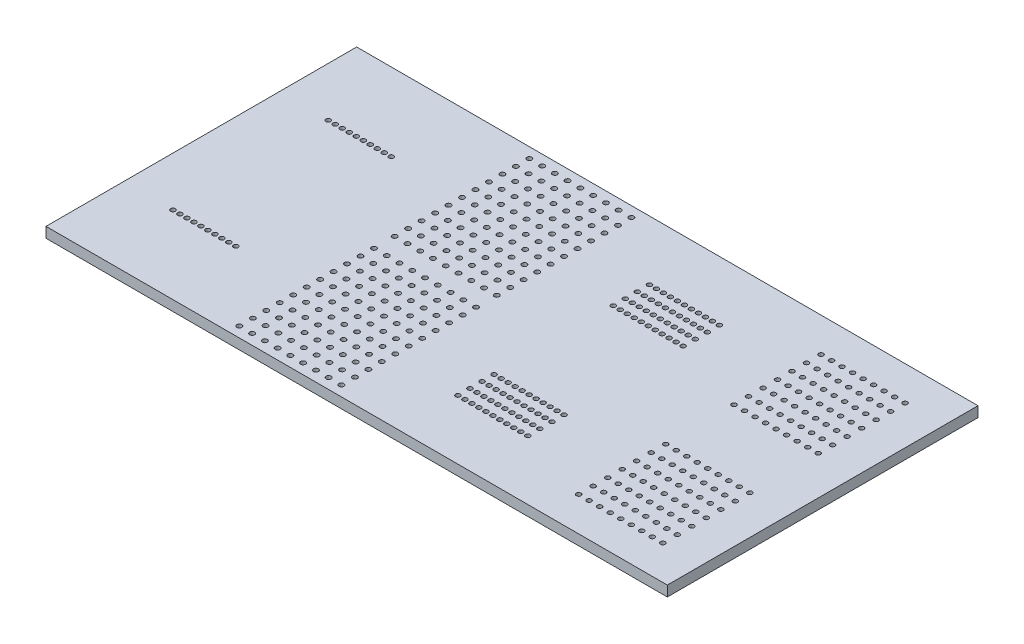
SolidWorks part; units mm, degrees
ref_plane "Plan de face" through (0, 0, 0) normal (0, 0, 1) x (1, 0, 0)
ref_plane "Plan de dessus" through (0, 0, 0) normal (0, 1, 0) x (1, 0, 0)
ref_plane "Plan de droite" through (0, 0, 0) normal (1, 0, 0) x (0, 0, -1)
sketch "Esquisse2" plane through (0, 0, 0) normal (0, 1, 0) x (1, 0, 0)
  line L1 (-60, -15) -> (60, -15)
  line L2 (-60, -15) -> (-60, 15)
  line L3 (-60, 15) -> (60, 15)
  line L4 (60, -15) -> (60, 15)
  line L5 (-60, -15) -> (60, 15) construction
  line L6 (-60, 15) -> (60, -15) construction
  point P0 (0, 0)
  dimension "D1" = 30
  dimension "D2" = 120
extrude "Boss.-Extru.1" add sketch "Esquisse2" along normal blind 2 contours L3 L4 L1 L2
sketch "Cavités" plane through (0, 0, 0) normal (0, 1, 0) x (1, 0, 0)
  line L0 (-60, -15) -> (60, -15) construction
  line L1 (-58.4, 15) -> (-30.4, 15) construction
  line L2 (-58.4, 15) -> (-58.4, -15) construction
  line L3 (-58.4, -15) -> (-30.4, -15) construction
  line L4 (-30.4, 15) -> (-30.4, -15) construction
  line L5 (-60, 15) -> (60, 15) construction
  line L6 (-28.8, 15) -> (-0.8, 15) construction
  line L7 (-28.8, 15) -> (-28.8, -15) construction
  line L8 (-28.8, -15) -> (-0.8, -15) construction
  line L9 (-0.8, 15) -> (-0.8, -15) construction
  line L10 (-30.4, 15) -> (-28.8, 15) construction
  line L11 (0.8, 15) -> (28.8, 15) construction
  line L12 (0.8, 15) -> (0.8, -15) construction
  line L13 (0.8, -15) -> (28.8, -15) construction
  line L14 (28.8, 15) -> (28.8, -15) construction
  line L15 (30.4, 15) -> (58.4, 15) construction
  line L16 (30.4, 15) -> (30.4, -15) construction
  line L17 (30.4, -15) -> (58.4, -15) construction
  line L18 (58.4, 15) -> (58.4, -15) construction
  line L19 (-0.8, 15) -> (0.8, 15) construction
  line L20 (28.8, 15) -> (30.4, 15) construction
  line L21 (-60, 15) -> (-58.4, 15) construction
  line L22 (58.4, 15) -> (60, 15) construction
  dimension "D1" = 28
  dimension "D2" = 1.6
sketch "Esquisse7" plane through (0, 2, 0) normal (0, 1, 0) x (1, 0, 0)
  line L0 (-58.4, 0) -> (-50.475, 0) construction
  line L5 (-58.4, 15) -> (-58.4, -15) construction
  line L6 (-38.325, 0) -> (-30.4, 0) construction
  line L7 (-30.4, 15) -> (-30.4, -15) construction
  line L8 (-50.475, 0) -> (-38.325, 0) construction
  dimension "D1" = 12.15
sketch "Esquisse8" plane through (0, 2, 0) normal (0, 1, 0) x (1, 0, 0)
  circle A0 centre (-50.475, 0) radius 0.45
  dimension "D1" = 0.9
extrude "Enlèv. mat.-Extru.3" cut sketch "Esquisse8" against normal up to next
pattern_linear "Répétition linéaire4" count 10 spacing 1.35 along (1, 0, 0) of "Enlèv. mat.-Extru.3"
sketch "Esquisse9" plane through (0, 2, 0) normal (0, 1, 0) x (1, 0, 0)
  line L0 (-28.8, 0) -> (-24.656, 0) construction
  line L1 (-24.656, 13) -> (-4.944, 13) construction
  line L2 (-24.656, 13) -> (-24.656, -13) construction
  line L3 (-24.656, -13) -> (-4.944, -13) construction
  line L4 (-4.944, 13) -> (-4.944, -13) construction
  line L5 (-28.8, 15) -> (-28.8, -15) construction
  line L6 (-4.944, 0) -> (-0.8, 0) construction
  line L7 (-0.8, 15) -> (-0.8, -15) construction
  dimension "D1" = 19.712
  dimension "D2" = 26
sketch "Esquisse10" plane through (0, 2, 0) normal (0, 1, 0) x (1, 0, 0)
  circle A0 centre (-24.656, 13) radius 0.475
  dimension "D1" = 0.95
extrude "Enlèv. mat.-Extru.4" cut sketch "Esquisse10" against normal up to next
pattern_linear "Répétition linéaire5" count 9 spacing 2.464 along (1, 0, 0) count 11 spacing 2.6 along (0, 0, 1) of "Enlèv. mat.-Extru.4"
sketch "Esquisse11" plane through (0, 2, 0) normal (0, 1, 0) x (1, 0, 0)
  line L0 (0.8, 0) -> (8.05, 0) construction
  line L1 (8.05, 3.4995) -> (21.55, 3.4995) construction
  line L2 (8.05, 3.4995) -> (8.05, -3.4995) construction
  line L3 (8.05, -3.4995) -> (21.55, -3.4995) construction
  line L4 (21.55, 3.4995) -> (21.55, -3.4995) construction
  line L5 (0.8, 15) -> (0.8, -15) construction
  line L6 (21.55, 0) -> (28.8, 0) construction
  line L7 (28.8, 15) -> (28.8, -15) construction
  dimension "D1" = 13.5
  dimension "D2" = 6.999
sketch "Esquisse12" plane through (0, 2, 0) normal (0, 1, 0) x (1, 0, 0)
  circle A0 centre (8.05, 3.4995) radius 0.45
  dimension "D1" = 0.9
extrude "Enlèv. mat.-Extru.5" cut sketch "Esquisse12" against normal up to next
pattern_linear "Répétition linéaire6" count 11 spacing 1.35 along (1, 0, 0) count 4 spacing 2.333 along (0, 0, 1) of "Enlèv. mat.-Extru.5"
sketch "Esquisse13" plane through (0, 2, 0) normal (0, 1, 0) x (1, 0, 0)
  line L0 (30.4, 0) -> (36.28, 0) construction
  line L1 (36.28, 8.4) -> (52.52, 8.4) construction
  line L2 (36.28, 8.4) -> (36.28, -8.4) construction
  line L3 (36.28, -8.4) -> (52.52, -8.4) construction
  line L4 (52.52, 8.4) -> (52.52, -8.4) construction
  line L5 (30.4, 15) -> (30.4, -15) construction
  line L6 (52.52, 0) -> (58.4, 0) construction
  line L7 (58.4, 15) -> (58.4, -15) construction
  dimension "D1" = 16.8
  dimension "D2" = 16.24
sketch "Esquisse14" plane through (0, 2, 0) normal (0, 1, 0) x (1, 0, 0)
  circle A0 centre (36.28, 8.4) radius 0.45
  dimension "D1" = 0.9
extrude "Enlèv. mat.-Extru.6" cut sketch "Esquisse14" against normal up to next
pattern_linear "Répétition linéaire7" count 9 spacing 2.03 along (1, 0, 0) count 7 spacing 2.8 along (0, 0, 1) of "Enlèv. mat.-Extru.6"
mirror "Symétrie1" about plane through (-60, 2, 15) normal (0, 0, -1)
